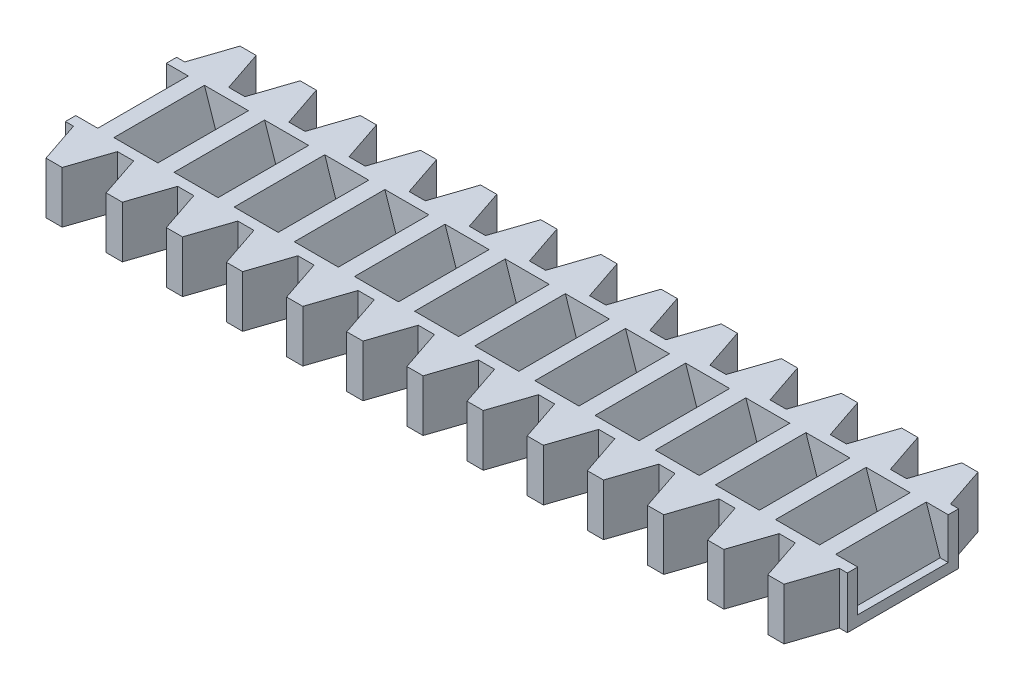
SolidWorks part; units mm, degrees
ref_plane "前视基准面" through (0, 0, 0) normal (0, 0, 1) x (1, 0, 0)
ref_plane "上视基准面" through (0, 0, 0) normal (0, 1, 0) x (1, 0, 0)
ref_plane "右视基准面" through (0, 0, 0) normal (1, 0, 0) x (0, 0, -1)
sketch "草图1" plane through (0, 0, 0) normal (0, 1, 0) x (1, 0, 0)
  line L0 (2.325, -4.3) -> (2.325, 4.3)
  line L1 (2.325, -4.3) -> (-2.325, -4.3)
  line L2 (2.325, 4.3) -> (-2.325, 4.3)
  line L3 (-2.325, -4.3) -> (-2.325, 4.3)
  line L4 (2.325, -4.3) -> (-2.325, 4.3) construction
  line L5 (2.325, 4.3) -> (-2.325, -4.3) construction
  point P1 (0, 0)
  dimension "D1" = 8.6
  dimension "D2" = 4.65
extrude "凸台-拉伸1" add sketch "草图1" along normal blind 4
sketch "草图3" plane through (0, 0, 0) normal (0, 1, 0) x (1, 0, 0)
  line L0 (0, 0) -> (0, 4.3) construction
  line L1 (2.325, 4.3) -> (-2.325, 4.3) construction
  line L2 (0, 4.3) -> (0, 7.5) construction
  line L3 (0.625, 7.5) -> (-0.625, 7.5)
  line L4 (1.7, 4.3) -> (-1.7, 4.3)
  line L5 (-0.625, 7.5) -> (-1.7, 4.3)
  line L6 (0.625, 7.5) -> (1.7, 4.3)
  dimension "D1" = 3.2
  dimension "D2" = 1.7
  dimension "D3" = 0.625
extrude "凸台-拉伸2" add sketch "草图3" along normal blind 4
mirror "镜向1" about plane through (0, 0, 0) normal (0, 0, 1) of "凸台-拉伸2"
sketch "草图4" plane through (0, 0, 0) normal (0, 0, 1) x (1, 0, 0)
  line L0 (0, 0) -> (0, 0.8) construction
  line L1 (0.625, 0) -> (-0.625, 0) construction
  line L2 (0, 0.8) -> (0, 4) construction
  line L3 (0.625, 4) -> (-0.625, 4) construction
  line L4 (0, 4) -> (-0.625, 4) construction
  line L5 (-0.625, 4) -> (-1.7, 4) construction
  line L6 (-0.625, 4) -> (-2.325, 4)
  line L7 (0, 0.8) -> (-1.7, 0.8) construction
  line L8 (-1.7, 0.8) -> (-2.325, 0.8)
  line L9 (-2.325, 4) -> (-2.325, 0) construction
  line L10 (-2.325, 4) -> (-2.325, 0.8)
  line L11 (-0.625, 4) -> (-1.7, 0.8)
  line L12 (1.7, 0.8) -> (2.325, 0.8)
  line L13 (2.325, 4) -> (2.325, 0.8)
  line L14 (0.625, 4) -> (1.7, 0.8)
  line L15 (0.625, 4) -> (2.325, 4)
  dimension "D1" = 0.8
  dimension "D2" = 0.625
  dimension "D3" = 1.7
extrude "切除-拉伸1" cut sketch "草图4" against normal blind 3.5 and the other way blind 3.5
pattern_linear "阵列(线性)4" count 13 spacing 4.65 along (1, 0, 0) of "凸台-拉伸1", "凸台-拉伸2", "镜向1", "切除-拉伸1"
sketch "草图6" plane through (0, 0, 0) normal (1, 0, 0) x (0, 0, -1)
  line L0 (0, 0) -> (0, -2) construction
  line L1 (0, -2) -> (0, -2.5) construction
  line L2 (1.5, 0) -> (0.5, 0)
  line L3 (-4.3, 0) -> (4.3, 0) construction
  line L4 (1.5, 0) -> (1.5, -0.6771)
  line L5 (1.1658, -2.5) -> (1.95, -2.5)
  line L6 (1.95, -2.5) -> (1.95, -1.5556)
  line L7 (0.5, -1.0723) -> (1.1658, -2.5)
  line L8 (0.5, 0) -> (0.5, -1.0723)
  line L9 (-0.5, -1.0723) -> (-1.1658, -2.5)
  line L10 (-1.1658, -2.5) -> (-1.95, -2.5)
  line L11 (-1.95, -2.5) -> (-1.95, -1.5556)
  line L12 (-1.5, 0) -> (-1.5, -0.6771)
  line L13 (-0.5, 0) -> (-0.5, -1.0723)
  line L14 (-1.5, 0) -> (-0.5, 0)
  arc A0 (1.95, -1.5556) -> (1.5, -0.6771) centre (0, -2) ccw
  arc A1 (-1.95, -1.5556) -> (-1.5, -0.6771) centre (0, -2) cw
  dimension "D1" = 2
  dimension "D2" = 0.5
  dimension "D3" = 1.5
  dimension "D4" = 1.95
  dimension "D5" = 25
  dimension "D6" = 1
extrude "凸台-拉伸4" add sketch "草图6" along normal blind 53.8 from offset 1
fillet "圆角1" radius 0.1 8 edges at (27.9, -2.5, -1.1658) (54.8, -2.5, -1.5579) (27.9, -2.5, -1.95) (1, -2.5, -1.5579) (27.9, -2.5, 1.95) (54.8, -2.5, 1.5579) (27.9, -2.5, 1.1658) (1, -2.5, 1.5579)
